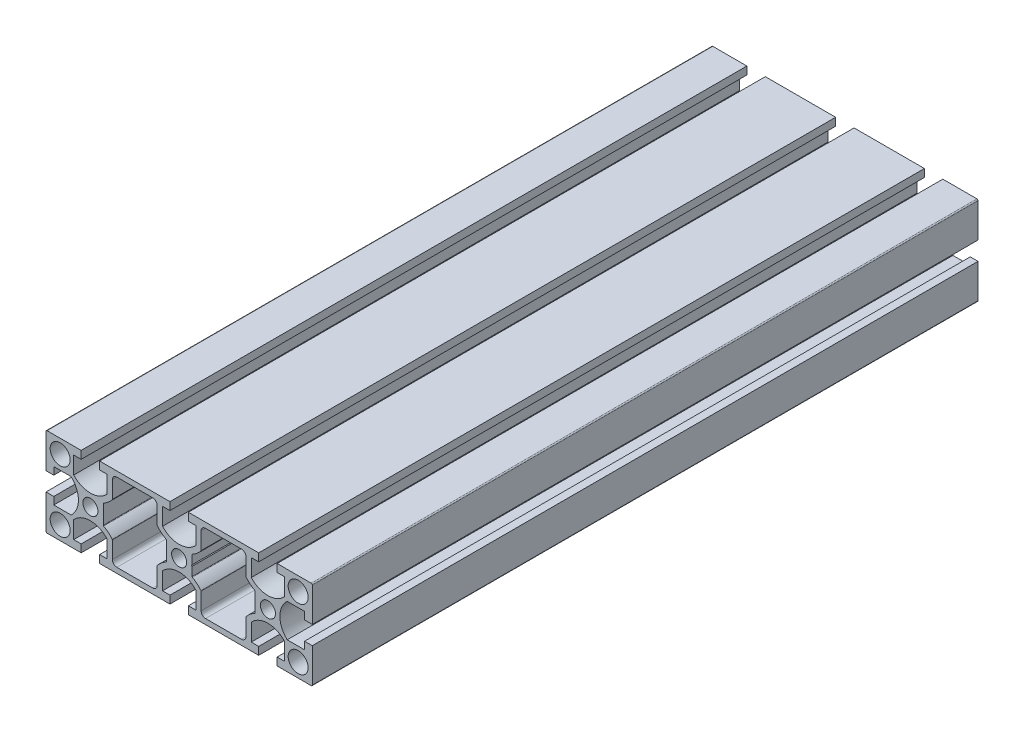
SolidWorks part; units mm, degrees
ref_plane "前视基准面" through (0, 0, 0) normal (0, 0, 1) x (1, 0, 0)
ref_plane "上视基准面" through (0, 0, 0) normal (0, 1, 0) x (1, 0, 0)
ref_plane "右视基准面" through (0, 0, 0) normal (1, 0, 0) x (0, 0, -1)
sketch "Model" plane through (0, 0, 0) normal (0, 0, 1) x (1, 0, 0)
  line L0 (2056.0308, 1297.8056) -> (2056.0308, 1305.6056)
  line L1 (2056.0308, 1305.6056) -> (2059.3808, 1305.6056)
  line L2 (2059.3808, 1305.6056) -> (2059.3808, 1309.1056)
  line L3 (2059.3808, 1309.1056) -> (2044.0308, 1309.1056)
  line L4 (2043.5308, 1308.6056) -> (2043.5308, 1293.2556)
  line L5 (2043.5308, 1293.2556) -> (2047.0308, 1293.2556)
  line L6 (2047.0308, 1293.2556) -> (2047.0308, 1296.6056)
  line L7 (2047.0308, 1296.6056) -> (2054.8308, 1296.6056)
  line L8 (2054.8308, 1281.6056) -> (2047.0308, 1281.6056)
  line L9 (2047.0308, 1281.6056) -> (2047.0308, 1284.9556)
  line L10 (2047.0308, 1284.9556) -> (2043.5308, 1284.9556)
  line L11 (2043.5308, 1284.9556) -> (2043.5308, 1269.6056)
  line L12 (2044.0308, 1269.1056) -> (2059.3808, 1269.1056)
  line L13 (2059.3808, 1269.1056) -> (2059.3808, 1272.6056)
  line L14 (2059.3808, 1272.6056) -> (2056.0308, 1272.6056)
  line L15 (2056.0308, 1272.6056) -> (2056.0308, 1280.4056)
  line L16 (2071.0308, 1280.4056) -> (2071.0308, 1272.6056)
  line L17 (2071.0308, 1272.6056) -> (2067.6808, 1272.6056)
  line L18 (2067.6808, 1272.6056) -> (2067.6808, 1269.1056)
  line L19 (2067.6808, 1269.1056) -> (2099.3808, 1269.1056)
  line L20 (2099.3808, 1269.1056) -> (2099.3808, 1272.6056)
  line L21 (2099.3808, 1272.6056) -> (2096.0308, 1272.6056)
  line L22 (2096.0308, 1272.6056) -> (2096.0308, 1280.4056)
  line L23 (2111.0308, 1280.4056) -> (2111.0308, 1272.6056)
  line L24 (2111.0308, 1272.6056) -> (2107.6808, 1272.6056)
  line L25 (2107.6808, 1272.6056) -> (2107.6808, 1269.1056)
  line L26 (2107.6808, 1269.1056) -> (2139.3808, 1269.1056)
  line L27 (2139.3808, 1269.1056) -> (2139.3808, 1272.6056)
  line L28 (2139.3808, 1272.6056) -> (2136.0308, 1272.6056)
  line L29 (2136.0308, 1272.6056) -> (2136.0308, 1280.4056)
  line L30 (2151.0308, 1280.4056) -> (2151.0308, 1272.6056)
  line L31 (2151.0308, 1272.6056) -> (2147.6808, 1272.6056)
  line L32 (2147.6808, 1272.6056) -> (2147.6808, 1269.1056)
  line L33 (2147.6808, 1269.1056) -> (2163.0308, 1269.1056)
  line L34 (2163.5308, 1269.6056) -> (2163.5308, 1284.9556)
  line L35 (2163.5308, 1284.9556) -> (2160.0308, 1284.9556)
  line L36 (2160.0308, 1284.9556) -> (2160.0308, 1281.6056)
  line L37 (2160.0308, 1281.6056) -> (2152.2308, 1281.6056)
  line L38 (2152.2308, 1296.6056) -> (2160.0308, 1296.6056)
  line L39 (2160.0308, 1296.6056) -> (2160.0308, 1293.2556)
  line L40 (2160.0308, 1293.2556) -> (2163.5308, 1293.2556)
  line L41 (2163.5308, 1293.2556) -> (2163.5308, 1308.6056)
  line L42 (2163.0308, 1309.1056) -> (2147.6808, 1309.1056)
  line L43 (2147.6808, 1309.1056) -> (2147.6808, 1305.6056)
  line L44 (2147.6808, 1305.6056) -> (2151.0308, 1305.6056)
  line L45 (2151.0308, 1305.6056) -> (2151.0308, 1297.8056)
  line L46 (2136.0308, 1297.8056) -> (2136.0308, 1305.6056)
  line L47 (2136.0308, 1305.6056) -> (2139.3808, 1305.6056)
  line L48 (2139.3808, 1305.6056) -> (2139.3808, 1309.1056)
  line L49 (2139.3808, 1309.1056) -> (2107.6808, 1309.1056)
  line L50 (2107.6808, 1309.1056) -> (2107.6808, 1305.6056)
  line L51 (2107.6808, 1305.6056) -> (2111.0308, 1305.6056)
  line L52 (2111.0308, 1305.6056) -> (2111.0308, 1297.8056)
  line L53 (2096.0308, 1297.8056) -> (2096.0308, 1305.6056)
  line L54 (2096.0308, 1305.6056) -> (2099.3808, 1305.6056)
  line L55 (2099.3808, 1305.6056) -> (2099.3808, 1309.1056)
  line L56 (2099.3808, 1309.1056) -> (2067.6808, 1309.1056)
  line L57 (2067.6808, 1309.1056) -> (2067.6808, 1305.6056)
  line L58 (2067.6808, 1305.6056) -> (2071.0308, 1305.6056)
  line L59 (2071.0308, 1305.6056) -> (2071.0308, 1297.8056)
  line L60 (2069.3308, 1293.3426) -> (2069.3308, 1284.8685)
  line L61 (2073.4308, 1281.1788) -> (2073.4308, 1273.5056)
  line L62 (2075.4308, 1271.5056) -> (2091.6308, 1271.5056)
  line L63 (2093.6308, 1273.5056) -> (2093.6308, 1281.1788)
  line L64 (2097.7308, 1284.8685) -> (2097.7308, 1288.8056)
  line L65 (2097.7308, 1288.8056) -> (2098.0308, 1289.1056)
  line L66 (2098.0308, 1289.1056) -> (2097.7308, 1289.4056)
  line L67 (2097.7308, 1289.4056) -> (2097.7308, 1293.3426)
  line L68 (2093.6308, 1297.0324) -> (2093.6308, 1304.7056)
  line L69 (2091.6308, 1306.7056) -> (2075.4308, 1306.7056)
  line L70 (2073.4308, 1304.7056) -> (2073.4308, 1297.0324)
  line L71 (2137.7308, 1284.8685) -> (2137.7308, 1293.3426)
  line L72 (2133.6308, 1297.0324) -> (2133.6308, 1304.7056)
  line L73 (2131.6308, 1306.7056) -> (2115.4308, 1306.7056)
  line L74 (2113.4308, 1304.7056) -> (2113.4308, 1297.0324)
  line L75 (2109.3308, 1293.3426) -> (2109.3308, 1289.4056)
  line L76 (2109.3308, 1289.4056) -> (2109.0308, 1289.1056)
  line L77 (2109.0308, 1289.1056) -> (2109.3308, 1288.8056)
  line L78 (2109.3308, 1288.8056) -> (2109.3308, 1284.8685)
  line L79 (2113.4308, 1281.1788) -> (2113.4308, 1273.5056)
  line L80 (2115.4308, 1271.5056) -> (2131.6308, 1271.5056)
  line L81 (2133.6308, 1273.5056) -> (2133.6308, 1281.1788)
  arc A0 (2056.0308, 1297.8056) -> (2071.0308, 1297.8056) centre (2063.5308, 1304.6783) ccw
  arc A1 (2044.0308, 1309.1056) -> (2043.5308, 1308.6056) centre (2044.0308, 1308.6056) ccw
  arc A2 (2054.8308, 1281.6056) -> (2054.8308, 1296.6056) centre (2047.958, 1289.1056) ccw
  arc A3 (2043.5308, 1269.6056) -> (2044.0308, 1269.1056) centre (2044.0308, 1269.6056) ccw
  arc A4 (2071.0308, 1280.4056) -> (2056.0308, 1280.4056) centre (2063.5308, 1273.5329) ccw
  arc A5 (2111.0308, 1280.4056) -> (2096.0308, 1280.4056) centre (2103.5308, 1273.5329) ccw
  arc A6 (2151.0308, 1280.4056) -> (2136.0308, 1280.4056) centre (2143.5308, 1273.5329) ccw
  arc A7 (2163.0308, 1269.1056) -> (2163.5308, 1269.6056) centre (2163.0308, 1269.6056) ccw
  arc A8 (2152.2308, 1296.6056) -> (2152.2308, 1281.6056) centre (2159.1035, 1289.1056) ccw
  arc A9 (2163.5308, 1308.6056) -> (2163.0308, 1309.1056) centre (2163.0308, 1308.6056) ccw
  arc A10 (2136.0308, 1297.8056) -> (2151.0308, 1297.8056) centre (2143.5308, 1304.6783) ccw
  arc A11 (2096.0308, 1297.8056) -> (2111.0308, 1297.8056) centre (2103.5308, 1304.6783) ccw
  arc A12 (2069.4886, 1293.6068) -> (2069.3308, 1293.3426) centre (2069.6308, 1293.3426) ccw
  arc A13 (2069.3308, 1284.8685) -> (2069.4886, 1284.6043) centre (2069.6308, 1284.8685) ccw
  arc A14 (2073.3654, 1281.3657) -> (2069.4886, 1284.6043) centre (2063.5308, 1273.5329) ccw
  arc A15 (2073.4308, 1281.1788) -> (2073.3654, 1281.3657) centre (2073.1308, 1281.1788) ccw
  arc A16 (2073.4308, 1273.5056) -> (2075.4308, 1271.5056) centre (2075.4308, 1273.5056) ccw
  arc A17 (2091.6308, 1271.5056) -> (2093.6308, 1273.5056) centre (2091.6308, 1273.5056) ccw
  arc A18 (2093.6961, 1281.3657) -> (2093.6308, 1281.1788) centre (2093.9308, 1281.1788) ccw
  arc A19 (2097.5729, 1284.6043) -> (2093.6961, 1281.3657) centre (2103.5308, 1273.5329) ccw
  arc A20 (2097.5729, 1284.6043) -> (2097.7308, 1284.8685) centre (2097.4308, 1284.8685) ccw
  arc A21 (2097.7308, 1293.3426) -> (2097.5729, 1293.6068) centre (2097.4308, 1293.3426) ccw
  arc A22 (2093.6961, 1296.8455) -> (2097.5729, 1293.6068) centre (2103.5308, 1304.6783) ccw
  arc A23 (2093.6308, 1297.0324) -> (2093.6961, 1296.8455) centre (2093.9308, 1297.0324) ccw
  arc A24 (2093.6308, 1304.7056) -> (2091.6308, 1306.7056) centre (2091.6308, 1304.7056) ccw
  arc A25 (2075.4308, 1306.7056) -> (2073.4308, 1304.7056) centre (2075.4308, 1304.7056) ccw
  arc A26 (2073.3654, 1296.8455) -> (2073.4308, 1297.0324) centre (2073.1308, 1297.0324) ccw
  arc A27 (2069.4886, 1293.6068) -> (2073.3654, 1296.8455) centre (2063.5308, 1304.6783) ccw
  arc A28 (2137.7308, 1293.3426) -> (2137.5729, 1293.6068) centre (2137.4308, 1293.3426) ccw
  arc A29 (2133.6961, 1296.8455) -> (2137.5729, 1293.6068) centre (2143.5308, 1304.6783) ccw
  arc A30 (2133.6308, 1297.0324) -> (2133.6961, 1296.8455) centre (2133.9308, 1297.0324) ccw
  arc A31 (2133.6308, 1304.7056) -> (2131.6308, 1306.7056) centre (2131.6308, 1304.7056) ccw
  arc A32 (2115.4308, 1306.7056) -> (2113.4308, 1304.7056) centre (2115.4308, 1304.7056) ccw
  arc A33 (2113.3654, 1296.8455) -> (2113.4308, 1297.0324) centre (2113.1308, 1297.0324) ccw
  arc A34 (2109.4886, 1293.6068) -> (2113.3654, 1296.8455) centre (2103.5308, 1304.6783) ccw
  arc A35 (2109.4886, 1293.6068) -> (2109.3308, 1293.3426) centre (2109.6308, 1293.3426) ccw
  arc A36 (2109.3308, 1284.8685) -> (2109.4886, 1284.6043) centre (2109.6308, 1284.8685) ccw
  arc A37 (2113.3654, 1281.3657) -> (2109.4886, 1284.6043) centre (2103.5308, 1273.5329) ccw
  arc A38 (2113.4308, 1281.1788) -> (2113.3654, 1281.3657) centre (2113.1308, 1281.1788) ccw
  arc A39 (2113.4308, 1273.5056) -> (2115.4308, 1271.5056) centre (2115.4308, 1273.5056) ccw
  arc A40 (2131.6308, 1271.5056) -> (2133.6308, 1273.5056) centre (2131.6308, 1273.5056) ccw
  arc A41 (2133.6961, 1281.3657) -> (2133.6308, 1281.1788) centre (2133.9308, 1281.1788) ccw
  arc A42 (2137.5729, 1284.6043) -> (2133.6961, 1281.3657) centre (2143.5308, 1273.5329) ccw
  arc A43 (2137.5729, 1284.6043) -> (2137.7308, 1284.8685) centre (2137.4308, 1284.8685) ccw
  circle A44 centre (2049.9058, 1302.8556) radius 4.5
  circle A45 centre (2049.9058, 1275.3556) radius 4.5
  circle A46 centre (2063.5308, 1289.1056) radius 3.4
  circle A47 centre (2103.5308, 1289.1056) radius 3.4
  circle A48 centre (2157.1558, 1302.8556) radius 4.5
  circle A49 centre (2143.5308, 1289.1056) radius 3.4
  circle A50 centre (2157.1558, 1275.3556) radius 4.5
extrude "凸台-拉伸1" add sketch "Model" along normal blind 300
